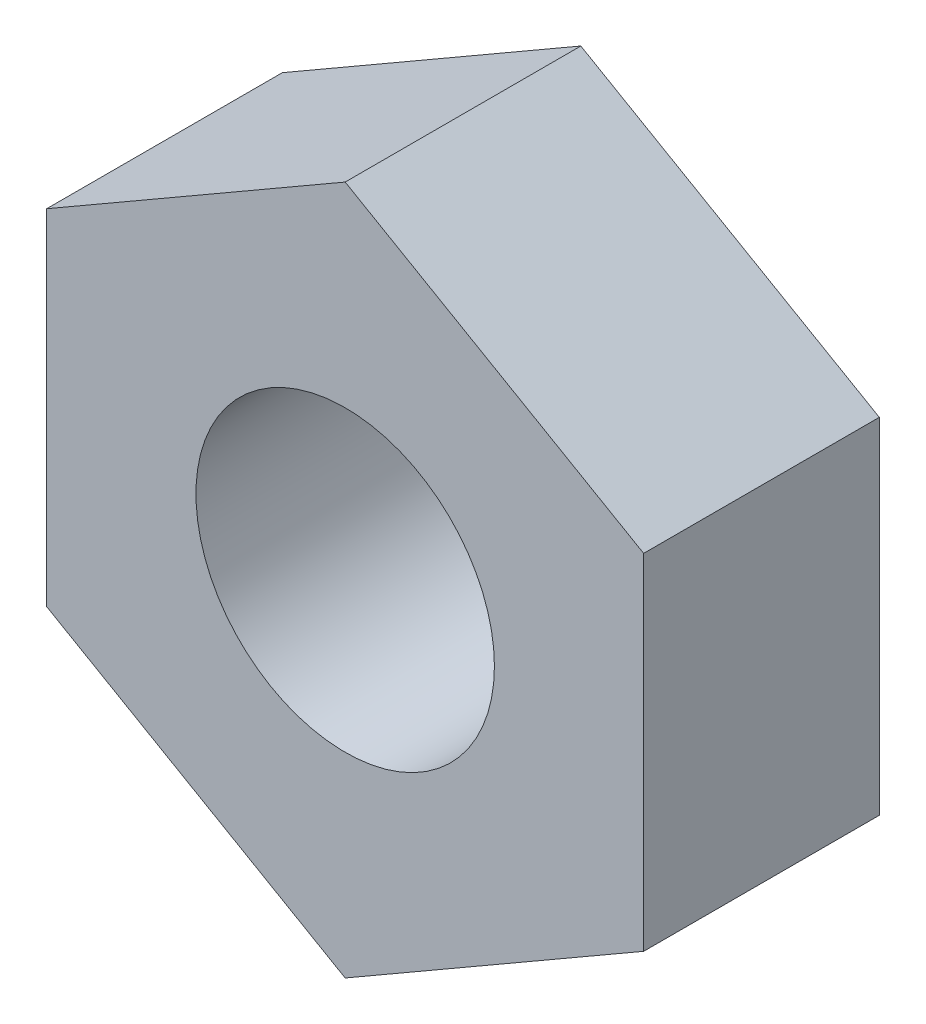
SolidWorks part; units mm, degrees
ref_plane "Plan de face" through (0, 0, 0) normal (0, 0, 1) x (1, 0, 0)
ref_plane "Plan de dessus" through (0, 0, 0) normal (0, 1, 0) x (1, 0, 0)
ref_plane "Plan de droite" through (0, 0, 0) normal (1, 0, 0) x (0, 0, -1)
sketch "Esquisse1" plane through (0, 0, 0) normal (0, 0, 1) x (1, 0, 0)
  line L1 (0, 2.1939) -> (-1.9, 1.097)
  line L2 (-1.9, 1.097) -> (-1.9, -1.097)
  line L3 (-1.9, -1.097) -> (0, -2.1939)
  line L4 (0, -2.1939) -> (1.9, -1.097)
  line L5 (1.9, -1.097) -> (1.9, 1.097)
  line L6 (1.9, 1.097) -> (0, 2.1939)
  circle A0 centre (0, 0) radius 1.9 construction
  circle A1 centre (0, 0) radius 0.95
extrude "Extrusion1" add sketch "Esquisse1" along normal blind 1.5
